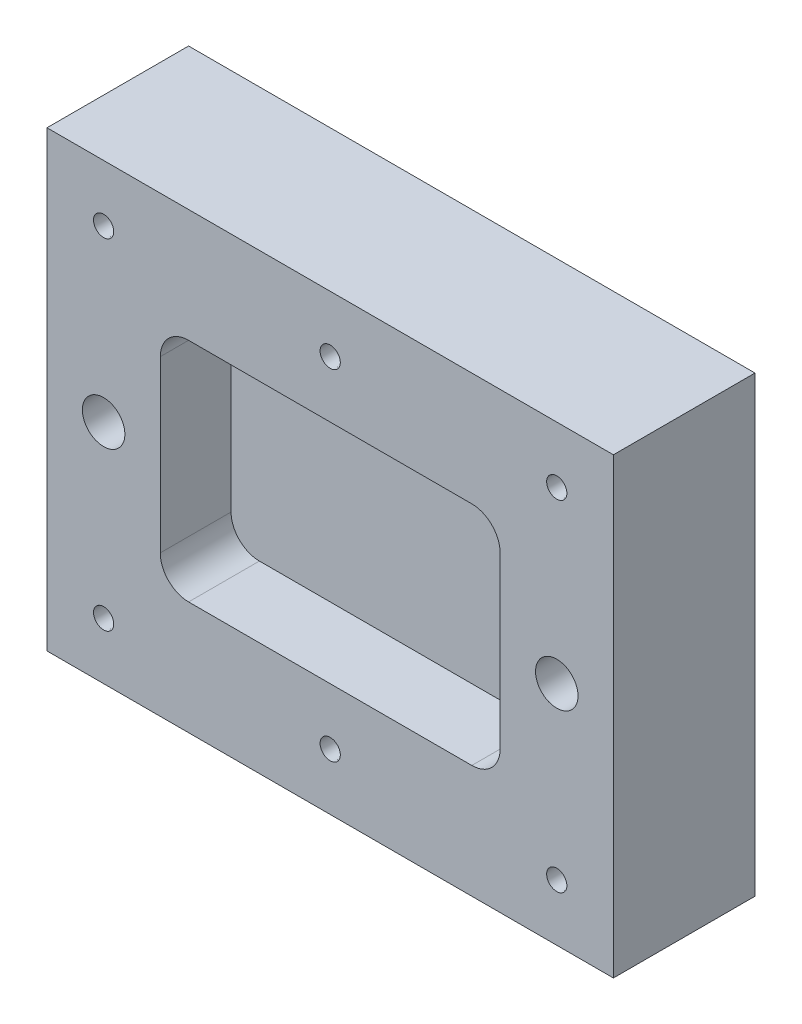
SolidWorks part; units mm, degrees
ref_plane "Plane1" through (0, 0, 0) normal (0, 0, 1) x (1, 0, 0)
ref_plane "Plane2" through (0, 0, 0) normal (0, 1, 0) x (1, 0, 0)
ref_plane "Plane3" through (0, 0, 0) normal (1, 0, 0) x (0, 0, -1)
sketch "Sketch1" plane through (0, 0, 0) normal (0, 0, 1) x (1, 0, 0)
  line L0 (-100, 80) -> (100, 80)
  line L1 (-100, 80) -> (-100, -80)
  line L2 (100, -80) -> (-100, -80)
  line L3 (100, -80) -> (100, 80)
extrude "Base-Extrude" add sketch "Sketch1" against normal blind 50
sketch "Sketch2" plane through (0, 0, 0) normal (0, 0, 1) x (1, 0, 0)
  line L0 (-50, 40) -> (50, 40)
  line L1 (-60, 30) -> (-60, -30)
  line L2 (50, -40) -> (-50, -40)
  line L3 (60, -30) -> (60, 30)
  arc A0 (-60, 30) -> (-50, 40) centre (-50, 30) cw
  arc A1 (-50, -40) -> (-60, -30) centre (-50, -30) cw
  arc A2 (60, -30) -> (50, -40) centre (50, -30) cw
  arc A3 (60, 30) -> (50, 40) centre (50, 30) ccw
  dimension "D1" = 10
extrude "Cut-Extrude1" cut sketch "Sketch2" against normal blind 25
hole_wizard "1/16 NPT Tapped Hole1" positions "Sketch5" profile "Sketch7" size "1/16" standard "ANSI Inch"
sketch "Sketch5" plane through (0, 0, 0) normal (0, 0, 1) x (1, 0, 0)
  line L1 (-80, -60) -> (80, -60) construction
  line L2 (-80, -60) -> (-80, 60) construction
  line L3 (-80, 60) -> (80, 60) construction
  line L4 (80, -60) -> (80, 60) construction
  line L5 (-80, -60) -> (80, 60) construction
  line L6 (-80, 60) -> (80, -60) construction
  line L7 (-100, 80) -> (100, 80) construction
  line L8 (-100, 80) -> (-100, -80) construction
  point P0 (-80, 60)
  point P2 (80, 60)
  point P4 (80, -60)
  point P6 (-80, -60)
  point P8 (0, -60)
  point P10 (0, 60)
  dimension "D1" = 20
  dimension "D2" = 20
sketch "Sketch7" plane through (-80, 60, 0) normal (1, 0, 0) x (0, -1, 0)
  line L0 (0, 0) -> (0, 50)
  line L1 (0, 50) -> (3.0734, 50)
  line L2 (-3.356, 6.89) -> (-3.5711, 0) construction
  line L3 (3.0734, 50) -> (3.0734, 6.89)
  line L4 (3.0734, 6.89) -> (3.356, 6.89)
  line L5 (3.356, 6.89) -> (3.5711, 0)
  line L7 (3.5711, 0) -> (0, 0)
  line L8 (0, -6.35) -> (0, 107.95) construction
  line L11 (-3.0734, 6.89) -> (-3.356, 6.89) construction
  dimension "Thru Tap Drill Dia." = 6.1468
  dimension "Thru Tap Drill Depth" = 50
  dimension "Thread Dia." = 7.1422
  dimension "Thread Angle" = 3.576
  dimension "Thread Depth" = 6.89
sketch "Sketch8" plane through (0, 0, 0) normal (0, 0, 1) x (1, 0, 0)
  line L0 (-80, -60) -> (-80, 60) construction
  line L1 (80, -60) -> (80, 60) construction
  circle A0 centre (-80, 0) radius 7.5
  circle A1 centre (80, 0) radius 7.5
  dimension "D1" = 15
extrude "Cut-Extrude2" cut sketch "Sketch8" against normal through all
